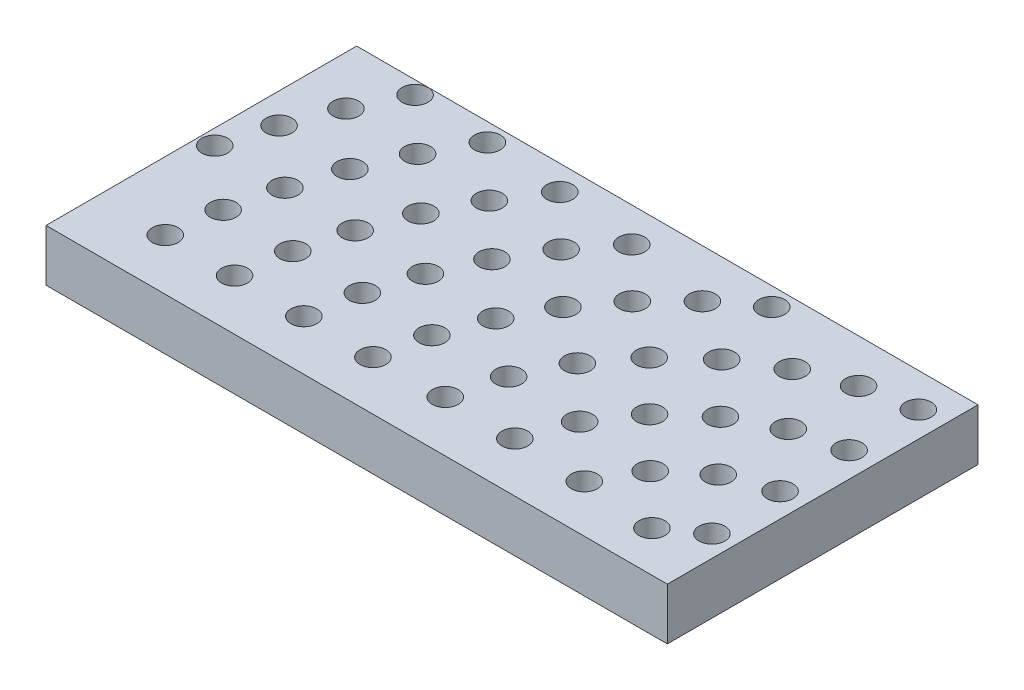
SolidWorks part; units mm, degrees
ref_plane "Front Plane" through (0, 0, 0) normal (0, 0, 1) x (1, 0, 0)
ref_plane "Top Plane" through (0, 0, 0) normal (0, 1, 0) x (1, 0, 0)
ref_plane "Right Plane" through (0, 0, 0) normal (1, 0, 0) x (0, 0, -1)
sketch "Sketch1" plane through (0, 0, 0) normal (0, 1, 0) x (1, 0, 0)
  line L1 (-76.2, 38.1) -> (76.2, 38.1)
  line L2 (-76.2, 38.1) -> (-76.2, -38.1)
  line L3 (-76.2, -38.1) -> (76.2, -38.1)
  line L4 (76.2, 38.1) -> (76.2, -38.1)
  dimension "D1" = 152.4
  dimension "D2" = 76.2
  dimension "D3" = 76.2
  dimension "D4" = 38.1
extrude "Extrude1" add sketch "Sketch1" along normal blind 12.7
other "Fill Pattern3" parameters "D10"=6.35, "D5"=0, "D6"=0, "D4"=17.0388, "D3"=0
